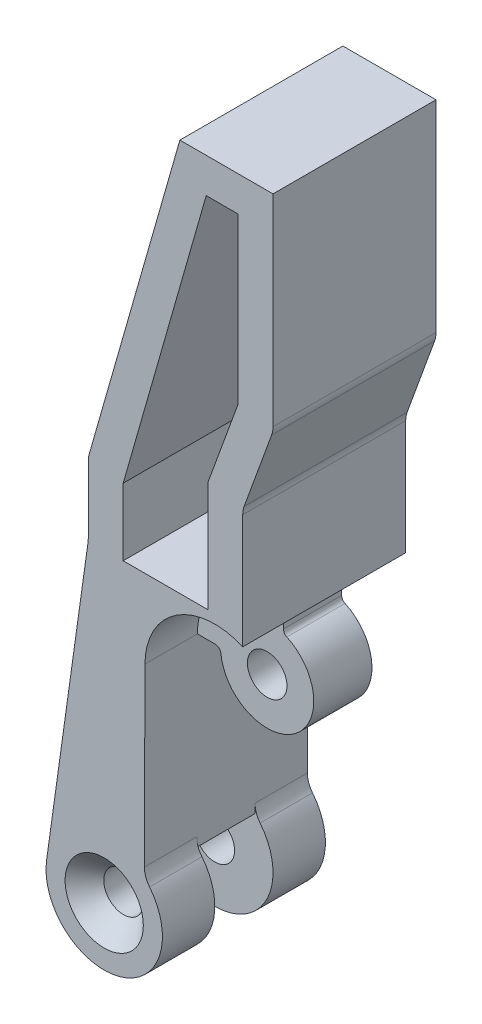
SolidWorks part; units mm, degrees
ref_plane "Front Plane" through (0, 0, 0) normal (0, 0, 1) x (1, 0, 0)
ref_plane "Top Plane" through (0, 0, 0) normal (0, 1, 0) x (1, 0, 0)
ref_plane "Right Plane" through (0, 0, 0) normal (1, 0, 0) x (0, 0, -1)
sketch "Sketch1" plane through (0, 0, 0) normal (0, 0, 1) x (1, 0, 0)
  line L0 (6.5, 60) -> (14.5, 60)
  line L1 (14.5, 60) -> (14.5, 42.3255)
  line L2 (14.5, 42.3255) -> (11.8979, 35.1811)
  line L3 (11.8979, 35.1811) -> (11.8979, 25)
  line L4 (6.5, 60) -> (-1.37, 32.4617)
  line L5 (-1.37, 32.4617) -> (-1.37, 26.2706)
  line L6 (-1.37, 26.2706) -> (-4.9517, 0.6934)
  line L7 (3.4491, 3.6199) -> (3.5, 19.5192)
  circle A0 centre (0, 0) radius 5
  arc A1 (11.8979, 25) -> (3.5, 19.5192) centre (9.5, 19.5) ccw
  dimension "D1" = 10
  dimension "D5" = 6
  dimension "D2" = 65
  dimension "D3" = 8
  dimension "D4" = 35
  dimension "D6" = 14.5
  dimension "D7" = 5
  dimension "D8" = 19.5
extrude "Boss-Extrude1" add sketch "Sketch1" along normal mid plane 14
sketch "Sketch2" plane through (0, 0, 7) normal (0, 0, 1) x (1, 0, 0)
  line L24 (1.63, 26.2706) -> (8.8979, 26.2706)
  line L30 (8.8979, 35.7104) -> (8.8979, 25)
  line L31 (1.63, 26.2706) -> (1.63, 32.0415)
  line L32 (11.5, 42.8548) -> (8.8979, 35.7104)
  line L33 (11.5, 57) -> (11.5, 42.8548)
  line L34 (8.7628, 57) -> (11.5, 57)
  line L35 (1.63, 32.0415) -> (8.7628, 57)
  line L36 (8.8979, 35.7104) -> (8.8979, 26.2706)
  line L37 (1.63, 26.2706) -> (1.63, 32.0415)
  line L38 (11.5, 42.8548) -> (8.8979, 35.7104)
  line L39 (11.5, 57) -> (11.5, 42.8548)
  line L40 (8.7628, 57) -> (11.5, 57)
  line L41 (1.63, 32.0415) -> (8.7628, 57)
  dimension "D1" = 3
extrude "Cut-Extrude1" cut sketch "Sketch2" against normal through all and the other way through all
sketch "Sketch3" plane through (0, 0, 0) normal (0, 0, 1) x (1, 0, 0)
  line L0 (3.5, 19.5192) -> (5.0258, 19.5192)
  line L1 (10.8979, 25.3349) -> (10.8979, 23.5802)
  line L2 (11.8979, 35.1811) -> (11.8979, 25) construction
  arc A0 (11.8979, 25) -> (3.5, 19.5192) centre (9.5, 19.5) ccw construction
  arc A1 (10.8979, 25.3349) -> (3.5, 19.5192) centre (9.5, 19.5) ccw
  arc A2 (5.5229, 19.0726) -> (11.187, 23.1268) centre (9.5, 19.5) ccw
  arc A3 (10.8979, 23.5802) -> (11.187, 23.1268) centre (11.3979, 23.5802) ccw
  arc A4 (5.0258, 19.5192) -> (5.5229, 19.0726) centre (5.0258, 19.0192) cw
  dimension "D1" = 8
  dimension "D3" = 0.5
  dimension "D2" = 1
extrude "Boss-Extrude2" add sketch "Sketch3" along normal mid plane 5
sketch "Sketch4" plane through (0, 0, 0) normal (0, 0, 1) x (1, 0, 0)
  circle A0 centre (0, 0) radius 5
  arc A1 (-4.9517, 0.6934) -> (3.4491, 3.6199) centre (0, 0) ccw construction
extrude "Cut-Extrude2" cut sketch "Sketch4" against normal mid plane 5
hole_wizard "M3 Clearance Hole1" positions "Sketch5" profile "Sketch6" hole size "M3" standard "ISO"
sketch "Sketch5" plane through (0, 0, 2.5) normal (0, 0, 1) x (1, 0, 0)
  point P0 (9.5, 19.5)
  point P4 (0, 0)
sketch "Sketch6" plane through (9.5, 19.5, 2.5) normal (1, 0, 0) x (0, -1, 0)
  line L0 (0, 0) -> (0, 9.5)
  line L1 (0, 9.5) -> (1.7, 9.5)
  line L2 (1.7, 9.5) -> (1.7, 0)
  line L5 (1.7, 0) -> (0, 0)
  line L11 (0, -6.35) -> (0, 107.95) construction
  dimension "Thru Hole Dia." = 3.4
  dimension "Thru Hole Depth" = 9.5
hole_wizard "CSK for M3 Hex Socket Countersunk Cap Screw1" positions "Sketch7" profile "Sketch8" countersink size "M3" standard "ISO"
sketch "Sketch7" plane through (0, 0, 7) normal (0, 0, 1) x (1, 0, 0)
  point P0 (0, 0)
sketch "Sketch8" plane through (0, 0, 7) normal (1, 0, 0) x (0, -1, 0)
  line L0 (0, 0) -> (0, 4.5)
  line L1 (0, 4.5) -> (1.7, 4.5)
  line L2 (1.7, 4.5) -> (1.7, 1.66)
  line L3 (1.7, 1.66) -> (3.36, 0)
  line L5 (3.36, 0) -> (0, 0)
  line L6 (-1.7, 1.66) -> (-3.36, 0) construction
  line L11 (0, -6.35) -> (0, 107.95) construction
  dimension "Thru Hole Dia." = 3.4
  dimension "Thru Hole Depth" = 4.5
  dimension "Near C'Sink Dia." = 6.72
  dimension "Near C'Sink Angle" = 90
fillet "Fillet1" radius 2 6 edges at (3.4491, 3.6199, -4.75) (3.4491, 3.6199, 4.75) (11.8979, 35.1811, 0) (14.5, 42.3255, 0) (-1.37, 32.4617, 0) (-1.37, 26.2706, 0)
